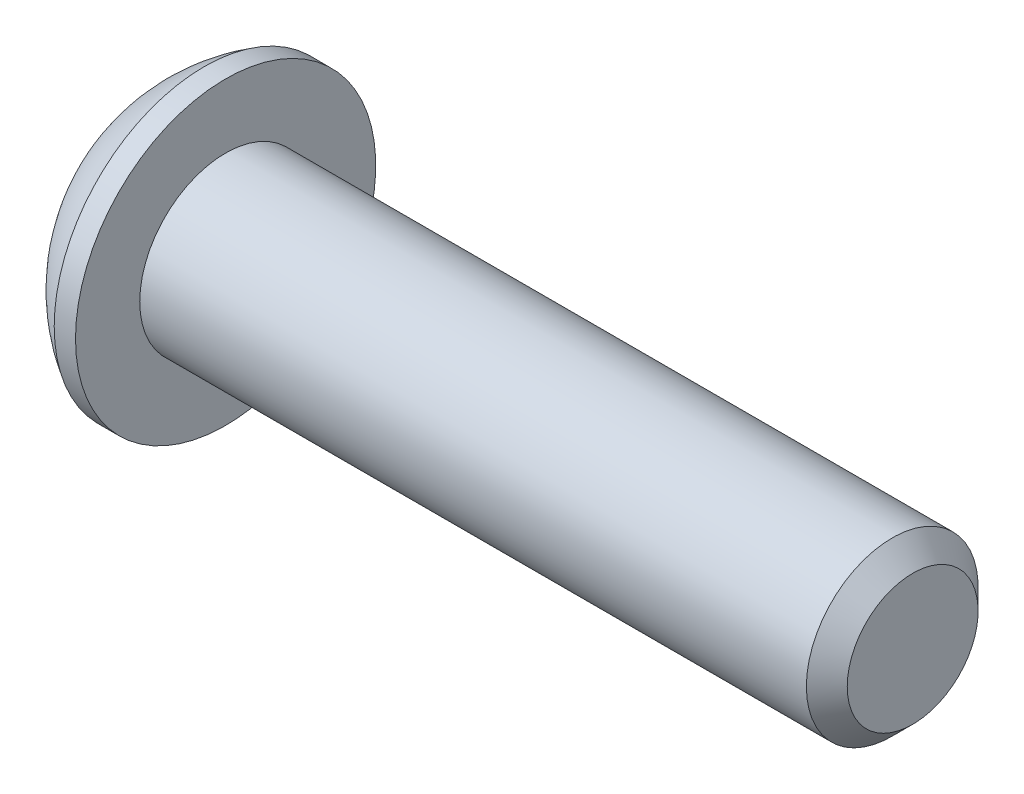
SolidWorks part; units mm, degrees
ref_plane "Plane1" through (0, 0, 0) normal (0, 0, 1) x (1, 0, 0)
ref_plane "Plane2" through (0, 0, 0) normal (0, 1, 0) x (1, 0, 0)
ref_plane "Plane3" through (0, 0, 0) normal (1, 0, 0) x (0, 0, -1)
sketch "BodySke" plane through (0, 0, 0) normal (0, 0, 1) x (1, 0, 0)
  line L0 (28.7528, 0) -> (28.7528, 2.4193)
  line L1 (27.9971, 3.175) -> (3.3528, 3.175)
  line L2 (3.3528, 3.175) -> (3.3528, 5.5499)
  line L3 (3.3528, 5.5499) -> (2.5654, 5.5499)
  line L4 (0, 0) -> (101.6, 0) construction
  line L5 (3.3528, -5.5499) -> (2.5654, -5.5499) construction
  line L6 (55.6768, -3.175) -> (3.3528, -3.175) construction
  line L7 (28.7528, 0) -> (0, 0)
  line L8 (0, 2.775) -> (0, -2.775) construction
  line L9 (0, 0) -> (0, 2.775)
  line L10 (28.7528, 2.4193) -> (27.9971, 3.175)
  line L11 (28.7528, -2.4193) -> (27.9971, -3.175) construction
  line L12 (4.6228, 9.525) -> (4.6228, -3.175) construction
  line L13 (3.3528, 9.525) -> (3.3528, -3.175) construction
  arc A1 (0, 2.775) -> (2.5654, 5.5499) centre (5.7851, 0) cw
  dimension "D1" = 5.5499
  dimension "Diameter" = 6.35
  dimension "Length" = 25.4
  dimension "Head_dia" = 11.0998
  dimension "Head_ht" = 3.3528
  dimension "Head_side_ht" = 0.7874
  dimension "Minor_dia" = 4.8387
  dimension "Body_ch_ang" = 45
  dimension "Advance" = 1.27
  dimension "Thread_nom" = 25.4
revolve "BaseBody" add sketch "BodySke" angle 360 about L4
sketch "Sketch2" plane through (0, 0, 0) normal (0, 0, 1) x (1, 0, 0)
  line L0 (0, 1.9812) -> (2.2098, 1.9812)
  line L1 (2.2098, 1.9812) -> (3.3536, 0)
  line L3 (3.3536, 0) -> (0, 0)
  line L4 (0, 0) -> (0, 1.9812)
  line L5 (0, -1.9812) -> (2.2098, -1.9812) construction
  line L6 (0, 0) -> (47.625, 0) construction
  dimension "D2" = 60
  dimension "PreBroach_depth" = 2.2098
  dimension "PreBroach_dia" = 3.9624
revolve "PreBroach" cut sketch "Sketch2" angle 360 about L6
sketch "Sketch3" plane through (0, 0, 0) normal (1, 0, 0) x (0, 0, -1)
  line L0 (-1.9812, -1.1438) -> (-1.9812, 1.1438)
  line L1 (-1.9812, 1.1438) -> (0, 2.2877)
  line L2 (0, 2.2877) -> (1.9812, 1.1438)
  line L3 (1.9812, 1.1438) -> (1.9812, -1.1438)
  line L4 (1.9812, -1.1438) -> (0, -2.2877)
  line L5 (0, -2.2877) -> (-1.9812, -1.1438)
  dimension "D1" = 1.9812
  dimension "D2" = 1.9812
  dimension "D3" = 3.9624
  dimension "Hex_size" = 3.9624
extrude "Hex" cut sketch "Sketch3" along normal blind 2.2098
sketch "Sketch4" plane through (0, 9.525, 0) normal (1, 0, 0) x (0, 0, -1)
  line L0 (0, -9.525) -> (2.3876, -9.525)
  line L1 (0, -9.525) -> (6.1484, -5.9752) construction
  line L2 (0, -9.525) -> (1.1938, -7.4573)
  line L3 (1.9883, -8.949) -> (2.2704, -8.7861)
  line L4 (1.493, -8.0911) -> (1.7751, -7.9282)
  arc A0 (1.9883, -8.949) -> (1.493, -8.0911) centre (0, -9.525) ccw
  arc A1 (2.3876, -9.525) -> (2.2704, -8.7861) centre (0, -9.525) ccw
  arc A2 (1.1938, -7.4573) -> (1.7751, -7.9282) centre (0, -9.525) cw
  dimension "D1" = 30
  dimension "Spline_n_dim" = 4.1402
  dimension "Spline_m_dim" = 4.7752
  dimension "D2" = 60
  dimension "D3" = 0.4953
  dimension "Spline_p_dim" = 0.9906
extrude "Spline" [suppressed] cut sketch "Sketch4" along normal blind 2.2098
pattern_circular "CirPattern1" [suppressed] count 6 every 60 about axis through (0, 0, 0) along (1, 0, 0)
sketch "ThdSchSke" plane through (0, 0, 0) normal (0, 0, 1) x (1, 0, 0)
  line L0 (4.6228, -2.4193) -> (4.0937, -3.175)
  line L1 (4.6228, -2.4193) -> (5.1519, -3.175)
  line L2 (5.1519, -3.175) -> (5.1519, -3.9688)
  line L3 (-3.175, 0) -> (5.1513, 0) construction
  line L5 (5.1519, -3.9688) -> (4.0937, -3.9688)
  line L6 (4.0937, -3.9688) -> (4.0937, -3.175)
  dimension "Thread_minor" = 4.8387
  dimension "Diameter" = 6.35
  dimension "Start" = 4.6228
  dimension "SideAngle" = 55
  dimension "VeeAngle" = 70
  dimension "Overcut" = 7.9375
revolve "ThreadSchematic" [suppressed] cut sketch "ThdSchSke" angle 360 about L3
pattern_linear "ThdSchPat" [suppressed]
equation "\"D1@BodySke\" = \"Head_dia@BodySke\" * .5"
equation "\"Thread_minor@ThreadCosmetic\" = \"Minor_dia@BodySke\""
equation "\"D1@Sketch3\" = \"Hex_size@Sketch3\" / 2"
equation "\"D2@Sketch3\" = \"D1@Sketch3\""
equation "\"D3@Sketch3\" = \"Hex_size@Sketch3\""
equation "\"D3@Sketch4\" = \"Spline_p_dim@Sketch4\" / 2"
equation "\"D1@Sketch4\" = \"D2@Sketch4\" / 2"
equation "\"Thread_length@ThreadCosmetic\" = ((sgn( (\"Length@BodySke\" - \"Advance@BodySke\" ) - \"Thread_nom@BodySke\" )-1)*( (\"Length@BodySke\" - \"Advance@BodySke\" ) - \"Thread_nom@BodySke\" ))/-2+ \"Thread_nom@BodySke\""
equation "\"Thread_minor@ThdSchSke\" = \"Minor_dia@BodySke\""
equation "\"Diameter@ThdSchSke\" = \"Diameter@BodySke\""
equation "\"Overcut@ThdSchSke\" = \"Diameter@BodySke\" * 1.25"
equation "\"Start@ThdSchSke\" = \"Head_ht@BodySke\" + \"Length@BodySke\" - \"Thread_length@ThreadCosmetic\"  '---Non-countersunk---"
equation "\"Num_threads@ThdSchPat\" = int( \"Thread_length@ThreadCosmetic\" / \"Advance@BodySke\" + 0.999 )  + 1"
equation "\"Advance@ThdSchPat\" = \"Thread_length@ThreadCosmetic\" /  (\"Num_threads@ThdSchPat\" - 1) 'relax it"
equation "\"Num_threads@ThdSchPat\" = \"Num_threads@ThdSchPat\" - sgn( \"Num_threads@ThdSchPat\" - 1) '---chamfered tips only---"
